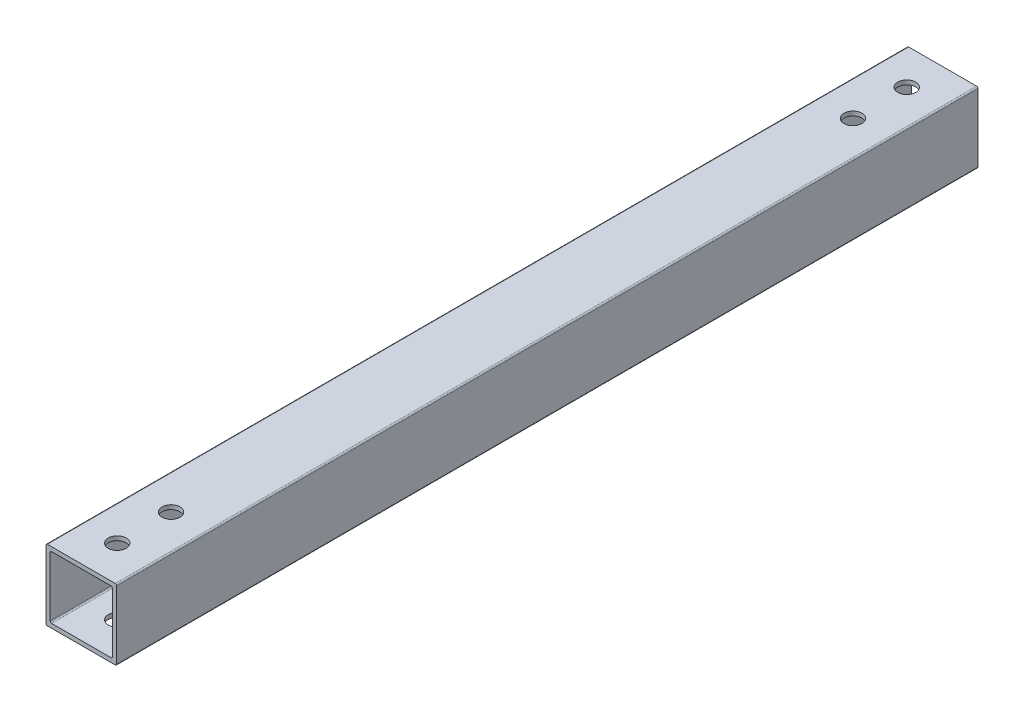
SolidWorks part; units mm, degrees
ref_plane "Front Plane" through (0, 0, 0) normal (0, 0, 1) x (1, 0, 0)
ref_plane "Top Plane" through (0, 0, 0) normal (0, 1, 0) x (1, 0, 0)
ref_plane "Right Plane" through (0, 0, 0) normal (1, 0, 0) x (0, 0, -1)
ref_plane "Plane1" through (0, 0, -2000) normal (0, 0, -1) x (-1, 0, 0)
sketch "Sketch1" plane through (0, 0, -2000) normal (0, 0, -1) x (-1, 0, 0)
  line L0 (11, 10.5) -> (11, -10.5)
  line L1 (10.5, -11) -> (-10.5, -11)
  line L2 (-11, -10.5) -> (-11, 10.5)
  line L3 (-10.5, 11) -> (10.5, 11)
  line L4 (12.5, -12) -> (12.5, 12)
  line L5 (12, 12.5) -> (-12, 12.5)
  line L6 (-12.5, 12) -> (-12.5, -12)
  line L7 (-12, -12.5) -> (12, -12.5)
  line L8 (0, 12.5) -> (0, -12.5) construction
  line L9 (-12.5, 0) -> (12.5, 0) construction
  arc A0 (11, -10.5) -> (10.5, -11) centre (10.5, -10.5) cw
  arc A1 (-10.5, -11) -> (-11, -10.5) centre (-10.5, -10.5) cw
  arc A2 (-11, 10.5) -> (-10.5, 11) centre (-10.5, 10.5) cw
  arc A3 (10.5, 11) -> (11, 10.5) centre (10.5, 10.5) cw
  arc A4 (12.5, 12) -> (12, 12.5) centre (12, 12) ccw
  arc A5 (-12, 12.5) -> (-12.5, 12) centre (-12, 12) ccw
  arc A6 (-12.5, -12) -> (-12, -12.5) centre (-12, -12) ccw
  arc A7 (12, -12.5) -> (12.5, -12) centre (12, -12) ccw
  dimension "D7" = 0.5
  dimension "D8" = 0.5
  dimension "D9" = 0.5
  dimension "D10" = 0.5
  dimension "D11" = 0.5
  dimension "D1" = 25
  dimension "D2" = 25
  dimension "D3" = 1.5
  dimension "D4" = 1.5
  dimension "D5" = 1.5
  dimension "D6" = 1.5
extrude "Boss-Extrude1" add sketch "Sketch1" against normal blind 304.8
sketch "Sketch2" plane through (0, 12.5, 0) normal (0, 1, 0) x (1, 0, 0)
  line L0 (0, 2000) -> (0, 1695.2) construction
  line L1 (-12, 2000) -> (12, 2000) construction
  line L2 (-12, 1695.2) -> (12, 1695.2) construction
  line L3 (-12, 1847.6) -> (12, 1847.6) construction
  line L4 (-12, 1695.2) -> (-12, 2000) construction
  line L5 (12, 1695.2) -> (12, 2000) construction
  circle A0 centre (0, 1987.3) radius 3.175
  circle A1 centre (0, 1968.25) radius 3.175
  circle A2 centre (0, 1707.9) radius 3.175
  circle A3 centre (0, 1726.95) radius 3.175
  dimension "D3" = 6.35
  dimension "D4" = 6.35
  dimension "D1" = 12.7
  dimension "D2" = 31.75
extrude "Cut-Extrude1" cut sketch "Sketch2" against normal up to surface (25 mm away)
